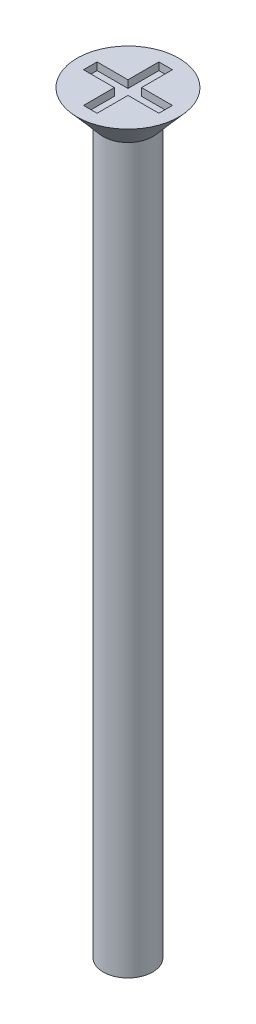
SolidWorks part; units mm, degrees
ref_plane " FRONT" through (0, 0, 0) normal (0, 0, 1) x (1, 0, 0)
ref_plane "TOP" through (0, 0, 0) normal (0, 1, 0) x (1, 0, 0)
ref_plane "SIDE" through (0, 0, 0) normal (1, 0, 0) x (0, 0, -1)
sketch "Sketch1" plane through (0, 0, 0) normal (0, 0, 1) x (1, 0, 0)
  line L0 (0, 90.8693) -> (0, -44.7514) construction
  line L1 (0, 0) -> (2.0828, 0)
  line L2 (2.0828, 0) -> (2.0828, 60.96)
  line L3 (2.0828, 60.96) -> (4.2908, 63.5)
  line L4 (4.2908, 63.5) -> (0, 63.5)
  line L5 (0, 0) -> (0, 63.5)
  dimension "ThreadDia" = 4.1656
  dimension "D1" = 139
  dimension "HeadHeight" = 2.54
  dimension "TotalLength" = 63.5
revolve "FLATHEAD" add sketch "Sketch1" angle 360 about L0
sketch "Sketch2" plane through (0, 63.5, 0) normal (0, 1, 0) x (-1, 0, 0)
  line L0 (-0.5715, 0) -> (0.5715, 0)
  line L1 (-0.5715, 0) -> (-0.5715, 3.175)
  line L2 (0.5715, 3.175) -> (-0.5715, 3.175)
  line L3 (0.5715, 3.175) -> (0.5715, 0)
  line L4 (0, 50) -> (0, -50) construction
  line L5 (50, 0) -> (-50, 0) construction
  dimension "PhillipsWidth" = 1.143
  dimension "D2" = 0.5715
  dimension "1/2PhillipsLength" = 3.175
extrude "PHILLIPS" cut sketch "Sketch2" against normal blind 0.635
pattern_circular "PHILLIPS PATTERN" count 4 every 90 about axis through (0, 90.8693, 0) along (0, -1, 0)
equation "\"D2@Sketch2\" = \"PhillipsWidth@Sketch2\" * .5"
